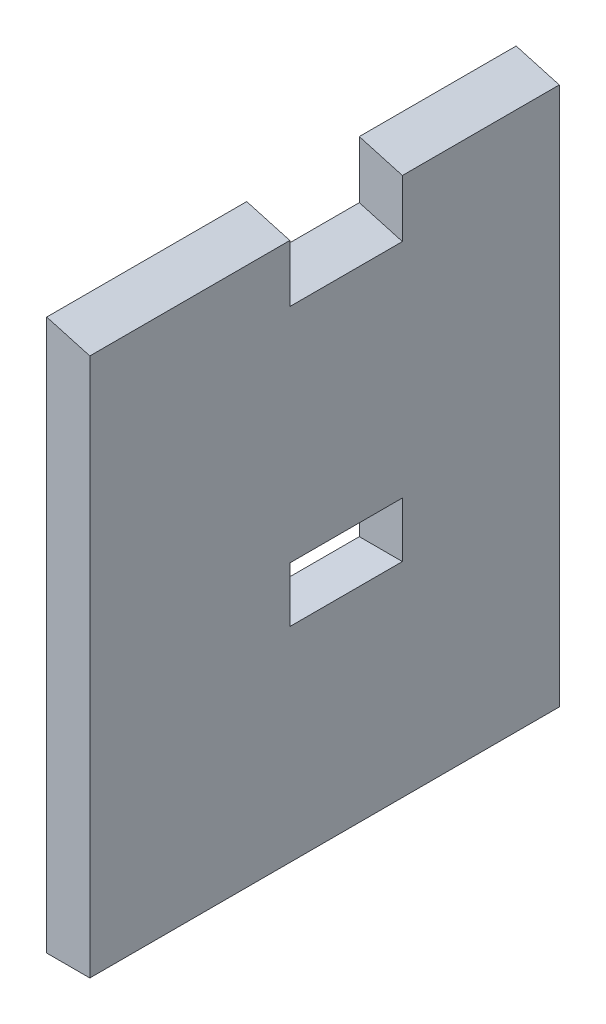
SolidWorks part; units mm, degrees
ref_plane "Plan de face" through (0, 0, 0) normal (0, 0, 1) x (1, 0, 0)
ref_plane "Plan de dessus" through (0, 0, 0) normal (0, 1, 0) x (1, 0, 0)
ref_plane "Plan de droite" through (0, 0, 0) normal (1, 0, 0) x (0, 0, -1)
sketch "Esquisse1" plane through (0, 0, 0) normal (0, 0, 1) x (1, 0, 0)
  line L0 (-9, 115) -> (9, 109.9313)
  line L1 (-9, 115) -> (9, 115)
  line L2 (-9, 115) -> (-9, -115)
  line L3 (-9, -115) -> (9, -115)
  line L4 (9, 115) -> (9, -115)
  line L5 (-9, 115) -> (9, -115) construction
  line L6 (-9, -115) -> (9, 115) construction
  arc A0 (3.2949, 115) -> (2.6046, 110.9384) centre (-9, 115) cw
  point P0 (0, 0)
  dimension "D3" = 224.9313
  dimension "D1" = 18
  dimension "D2" = 230
extrude "Boss.-Extru.1" add sketch "Esquisse1" along normal blind 196
sketch "Esquisse2" plane through (9, 0, 0) normal (1, 0, 0) x (0, 0, -1)
  line L0 (-196, 109.9313) -> (0, 109.9313) construction
  line L1 (-196, 109.9313) -> (-196, -115) construction
  line L3 (-112.5, -6.6687) -> (-65.5, -6.6687)
  line L4 (-112.5, -6.6687) -> (-112.5, -29.6687)
  line L5 (-112.5, -29.6687) -> (-65.5, -29.6687)
  line L6 (-65.5, -6.6687) -> (-65.5, -29.6687)
  line L7 (-112.5, -6.6687) -> (-65.5, -29.6687) construction
  line L8 (-112.5, -29.6687) -> (-65.5, -6.6687) construction
  point P0 (-89, -18.1687)
  point P5 (-89, -18.1687)
  dimension "D1" = 128.1
  dimension "D2" = 107
  dimension "D3" = 23
  dimension "D4" = 47
extrude "Enlèv. mat.-Extru.1" cut sketch "Esquisse2" against normal through all
sketch "Esquisse3" plane through (29.3431, 104.2027, 0) normal (0.2711, 0.9626, 0) x (0.9626, -0.2711, 0)
  line L3 (-39.8343, -196) -> (-21.1343, -196) construction
  line L4 (-54.152, -65.5) -> (1.7089, -65.5)
  line L5 (-54.152, -65.5) -> (-54.152, -112.5)
  line L6 (-54.152, -112.5) -> (1.7089, -112.5)
  line L7 (1.7089, -65.5) -> (1.7089, -112.5)
  line L8 (-54.152, -65.5) -> (1.7089, -112.5) construction
  line L9 (-54.152, -112.5) -> (1.7089, -65.5) construction
  point P0 (-30.4843, -196)
  point P3 (-26.2216, -89)
  point P8 (-26.2216, -89)
  dimension "D1" = 47
  dimension "D2" = 107
extrude "Enlèv. mat.-Extru.2" cut sketch "Esquisse3" against normal blind 23
